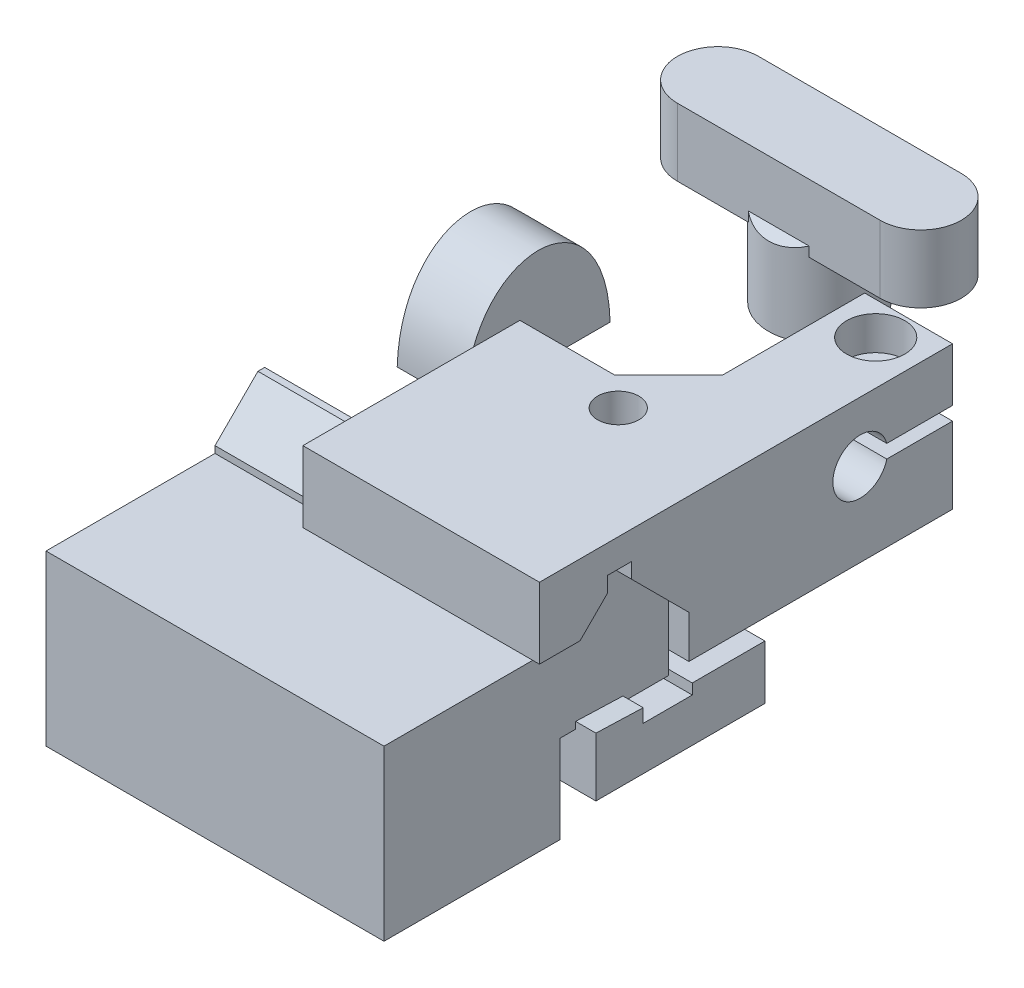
SolidWorks part; units mm, degrees
ref_plane "Top Plane" through (0, 0, 0) normal (0, 0, 1) x (1, 0, 0)
ref_plane "Front Plane" through (0, 0, 0) normal (0, 1, 0) x (1, 0, 0)
ref_plane "Right Plane" through (0, 0, 0) normal (1, 0, 0) x (0, 0, -1)
sketch "Sketch1" plane through (0, 0, 0) normal (1, 0, 0) x (0, 0, -1)
  line L0 (12.5, 12.5) -> (12.5, 13.5)
  line L7 (-12.5, 12.5) -> (12.5, 12.5)
  line L16 (-12.5, 12.5) -> (-12.5, -12.5)
  line L17 (-12.5, -12.5) -> (12.5, -12.5)
  line L18 (12.5, 12.5) -> (12.5, -12.5) construction
  line L19 (-12.5, 12.5) -> (12.5, -12.5) construction
  line L20 (-12.5, -12.5) -> (12.5, 12.5) construction
  line L21 (12.5, 13.5) -> (18.8489, 19.8489)
  line L22 (18.8489, 19.8489) -> (19.8489, 19.8489)
  line L23 (19.8489, 19.8489) -> (29.6019, 10.0958)
  line L24 (29.6019, 10.0958) -> (29.6019, 0.4958)
  line L25 (29.6019, 0.4958) -> (13.5519, 0.4958)
  line L26 (13.5519, 0.4958) -> (13.5519, -12.5)
  line L27 (12.5, -12.5) -> (13.5519, -12.5)
  line L28 (12.5, 13.5) -> (11.5, 12.5) construction
  line L29 (39.4519, 10.0958) -> (60.9519, 10.0958)
  line L30 (50.2019, 10.0958) -> (50.2019, 37.0743) construction
  line L31 (39.4519, 27.6363) -> (39.4519, -21.1762) construction
  line L32 (29.6019, 10.0958) -> (88.1638, 10.0958) construction
  spline S0 degree 3 poles (39.4519, 10.0958) (40.0358, 29.1067) (60.3681, 29.7517) (60.9519, 10.0958) knots 0 0 0 0 1 1 1 1
  point P1 (0, 0)
  point P20 (0, 0)
  dimension "D1" = 11.1
  dimension "D2" = 90
  dimension "D3" = 14.5
  dimension "D4" = 9.6
  dimension "D5" = 16.05
  dimension "D6" = 1
  dimension "D7" = 1
  dimension "D8" = 135
  dimension "D9" = 25
  dimension "D10" = 14.5
  dimension "D11" = 21.5
  dimension "D12" = 9.85
extrude "Boss-Extrude1" add sketch "Sketch1" against normal blind 10
sketch "Sketch2" plane through (0, 0, 0) normal (1, 0, 0) x (0, 0, -1)
  line L10 (-12.5, -12.5) -> (13.5519, -12.5)
  line L11 (13.5519, -12.5) -> (13.5519, 0.4958)
  line L12 (13.5519, 0.4958) -> (29.6019, 0.4958)
  line L13 (29.6019, 0.4958) -> (29.6019, 10.0958)
  line L14 (29.6019, 10.0958) -> (19.8489, 19.8489)
  line L15 (19.8489, 19.8489) -> (18.8489, 19.8489)
  line L16 (18.8489, 19.8489) -> (12.5, 13.5)
  line L17 (12.5, 13.5) -> (12.5, 12.5)
  line L18 (12.5, 12.5) -> (-12.5, 12.5)
  line L19 (-12.5, 12.5) -> (-12.5, -12.5)
  line L20 (-12.5, -12.5) -> (13.5519, -12.5)
  line L21 (13.5519, -12.5) -> (13.5519, 0.4958)
  line L22 (13.5519, 0.4958) -> (29.6019, 0.4958)
  line L23 (29.6019, 0.4958) -> (29.6019, 10.0958)
  line L24 (29.6019, 10.0958) -> (19.8489, 19.8489)
  line L25 (19.8489, 19.8489) -> (18.8489, 19.8489)
  line L26 (18.8489, 19.8489) -> (12.5, 13.5)
  line L27 (12.5, 13.5) -> (12.5, 12.5)
  line L28 (12.5, 12.5) -> (-12.5, 12.5)
  line L29 (-12.5, 12.5) -> (-12.5, -12.5)
  dimension "D1" = 0
extrude "Boss-Extrude2" add sketch "Sketch2" along normal blind 40
ref_plane "Plane1" through (30, 0, 0) normal (1, 0, 0) x (0, 0, -1)
sketch "Sketch3" plane through (30, 0, 0) normal (1, 0, 0) x (0, 0, -1)
  line L1 (39.4519, 10.0958) -> (60.9519, 10.0958)
  line L2 (39.4519, 10.0958) -> (60.9519, 10.0958) construction
  line L3 (7.5, 14.5) -> (7.5, 27.5)
  line L4 (7.5, 27.5) -> (64.6019, 27.5)
  line L6 (29.6019, 10.0958) -> (19.8489, 19.8489) construction
  line L10 (-12.5, 12.5) -> (-12.5, -12.5)
  line L11 (-12.5, -12.5) -> (13.5519, -12.5)
  line L12 (13.5519, -12.5) -> (13.5519, 0.4958)
  line L13 (13.5519, 0.4958) -> (29.6019, 0.4958)
  line L14 (29.6019, 0.4958) -> (29.6019, 10.0958)
  line L15 (29.6019, 10.0958) -> (19.8489, 19.8489)
  line L16 (19.8489, 19.8489) -> (18.8489, 19.8489)
  line L17 (18.8489, 19.8489) -> (12.5, 13.5)
  line L18 (12.5, 13.5) -> (12.5, 12.5)
  line L19 (12.5, 12.5) -> (-12.5, 12.5)
  line L20 (-12.5, 12.5) -> (-12.5, -12.5) construction
  line L21 (-12.5, -12.5) -> (13.5519, -12.5) construction
  line L22 (13.5519, -12.5) -> (13.5519, 0.4958) construction
  line L23 (13.5519, 0.4958) -> (29.6019, 0.4958) construction
  line L24 (29.6019, 0.4958) -> (29.6019, 10.0958) construction
  line L25 (29.6019, 10.0958) -> (19.8489, 19.8489) construction
  line L26 (19.8489, 19.8489) -> (18.8489, 19.8489) construction
  line L27 (18.8489, 19.8489) -> (12.5, 13.5) construction
  line L28 (12.5, 13.5) -> (12.5, 12.5) construction
  line L29 (12.5, 12.5) -> (-12.5, 12.5) construction
  line L30 (29.6019, 10.0958) -> (29.6019, 0.7958)
  line L31 (29.6019, 0.7958) -> (64.6019, 0.7958)
  line L32 (64.6019, 0.7958) -> (64.6019, 27.5)
  line L34 (13.5, 14.5) -> (7.5, 14.5)
  line L36 (17.5989, 18.5989) -> (17.5989, 20.8489)
  line L38 (29.6019, 10.0958) -> (21.0989, 18.5989)
  line L39 (21.0989, 18.5989) -> (21.0989, 20.8489)
  line L40 (19.3489, 19.8489) -> (19.3489, 21.4507) construction
  line L41 (17.5989, 20.8489) -> (19.3489, 20.8489)
  line L42 (19.3489, 20.8489) -> (21.0989, 20.8489)
  line L43 (13.5, 14.5) -> (17.5989, 18.5989)
  circle A0 centre (54.9519, 16.0958) radius 4.05
  spline S1 degree 3 poles (-2697.8887, -1126.5524) (3003.4516, 512.4412) (-2935.6643, 217.1374) (2890.523, -865.7362) knots -3.67734 -3.67734 -3.67734 -3.67734 4.722143 4.722143 4.722143 4.722143 only from (60.9519, 10.0958) to (39.4519, 10.0958)
  spline S2 degree 3 poles (60.9519, 10.0958) (60.3681, 29.7517) (40.0358, 29.1067) (39.4519, 10.0958) knots 0 0 0 0 1 1 1 1 construction
  dimension "D3" = 8.1
  dimension "D4" = 6
  dimension "D5" = 6
  dimension "D6" = 2
  dimension "D7" = 3.5
  dimension "D8" = 1
  dimension "D9" = 35
  dimension "D10" = 0.3
  dimension "D11" = 13
  dimension "D12" = 6
  dimension "D1" = 0
  dimension "D2" = 0
extrude "Boss-Extrude3" add sketch "Sketch3" along normal blind 13 separate body
sketch "Sketch10" plane through (30, 0, 0) normal (-1, 0, 0) x (0, 0, 1)
  line L0 (-39.6019, 27.5) -> (-39.6019, 0.7958)
  line L11 (-29.6019, 10.0958) -> (-21.0989, 18.5989)
  line L12 (-21.0989, 18.5989) -> (-21.0989, 20.8489)
  line L13 (-21.0989, 20.8489) -> (-17.5989, 20.8489)
  line L14 (-17.5989, 20.8489) -> (-17.5989, 18.5989)
  line L15 (-17.5989, 18.5989) -> (-13.5, 14.5)
  line L16 (-13.5, 14.5) -> (-7.5, 14.5)
  line L17 (-7.5, 14.5) -> (-7.5, 27.5)
  line L18 (-7.5, 27.5) -> (-64.6019, 27.5)
  line L19 (-64.6019, 27.5) -> (-64.6019, 0.7958)
  line L20 (-64.6019, 0.7958) -> (-29.6019, 0.7958)
  line L21 (-29.6019, 0.7958) -> (-29.6019, 10.0958)
  line L22 (-29.6019, 10.0958) -> (-21.0989, 18.5989)
  line L23 (-21.0989, 18.5989) -> (-21.0989, 20.8489)
  line L24 (-21.0989, 20.8489) -> (-17.5989, 20.8489)
  line L25 (-17.5989, 20.8489) -> (-17.5989, 18.5989)
  line L26 (-17.5989, 18.5989) -> (-13.5, 14.5)
  line L27 (-13.5, 14.5) -> (-7.5, 14.5)
  line L28 (-7.5, 14.5) -> (-7.5, 27.5)
  line L29 (-7.5, 27.5) -> (-64.6019, 27.5)
  line L30 (-64.6019, 27.5) -> (-64.6019, 0.7958)
  line L31 (-64.6019, 0.7958) -> (-29.6019, 0.7958)
  line L32 (-29.6019, 0.7958) -> (-29.6019, 10.0958)
  dimension "D2" = 10
  dimension "D1" = 0
extrude "Boss-Extrude8" add sketch "Sketch10" along normal blind 22 contours L0 M20 M22 M23 M13 M14 M15 M16 M17 M18 M19
chamfer "Chamfer2" distance 8 angle 45 1 edges at (30, 14.1479, -39.6019)
sketch "Sketch11" plane through (0, 27.5, 0) normal (0, 1, 0) x (1, 0, 0)
  line L0 (-10, 29.6019) -> (40, 29.6019) construction
  line L1 (-10, 29.6019) -> (40, 29.6019) construction
  line L2 (25.5, 7.5) -> (25.5, 64.8694) construction
  line L3 (43, 7.5) -> (8, 7.5) construction
  line L4 (40.6681, 32.6019) -> (11.2696, 32.6019) construction
  circle A0 centre (26.5, 35.6519) radius 3.05
  point P10 (27.3746, 35.6847)
  point P11 (27.0288, 35.6542)
  dimension "D3" = 6.1
  dimension "D1" = 3
  dimension "D2" = 1
extrude "Cut-Extrude4" cut sketch "Sketch11" against normal up to surface (26.7042 mm away)
sketch "Sketch13" plane through (43, 0, 0) normal (1, 0, 0) x (0, 0, -1)
  line L1 (15.851, 1.4958) -> (22.8468, 1.2515)
  line L4 (22.8468, 1.2515) -> (22.8468, -0.7485)
  line L5 (19.3489, 20.8489) -> (19.3489, -9.8371) construction
  line L6 (17.5989, 20.8489) -> (21.0989, 20.8489) construction
  line L7 (15.851, 1.4958) -> (15.851, -7.2042)
  line L8 (15.851, -7.2042) -> (40.851, -7.2042)
  line L9 (40.851, -7.2042) -> (40.851, 0.7958)
  line L10 (40.851, 0.7958) -> (30.1019, 0.7958)
  line L11 (30.1019, 0.7958) -> (30.1019, -0.7485)
  line L12 (30.1019, -0.7485) -> (22.8468, -0.7485)
  line L13 (29.6019, 0.4958) -> (29.6019, 10.0958) construction
  line L14 (13.5519, 0.4958) -> (29.6019, 0.4958) construction
  line L15 (29.6019, 0.7958) -> (64.6019, 0.7958) construction
  point P0 (22.8334, 0.9425)
  point P10 (19.3489, 1.3737)
  point P18 (0, 0)
  dimension "D1" = 6.9957
  dimension "D2" = 2
  dimension "D3" = 8
  dimension "D4" = 25
  dimension "D5" = 0.5
  dimension "D6" = 88
  dimension "D7" = 1
extrude "Boss-Extrude9" add sketch "Sketch13" against normal up to surface (35 mm away) separate body
sketch "Sketch18" plane through (0, 27.5, 0) normal (0, 1, 0) x (1, 0, 0)
  line L7 (30, 64.6019) -> (30, 47.6019)
  line L8 (30, 47.6019) -> (22, 39.6019)
  line L9 (22, 39.6019) -> (8, 39.6019)
  line L10 (8, 39.6019) -> (8, 7.5)
  line L11 (8, 7.5) -> (43, 7.5)
  line L12 (43, 7.5) -> (43, 64.6019)
  line L13 (43, 64.6019) -> (30, 64.6019)
  line L14 (30, 64.6019) -> (30, 47.6019)
  line L15 (30, 47.6019) -> (22, 39.6019)
  line L16 (22, 39.6019) -> (8, 39.6019)
  line L17 (8, 39.6019) -> (8, 7.5)
  line L18 (8, 7.5) -> (43, 7.5)
  line L19 (43, 7.5) -> (43, 64.6019)
  line L20 (43, 64.6019) -> (30, 64.6019)
  dimension "D1" = 0
extrude "Cut-Extrude8" cut sketch "Sketch18" against normal blind 2.5
sketch "Sketch19" plane through (0, 0, 0) normal (0, 1, 0) x (1, 0, 0)
  line L1 (1.0565, 88.0726) -> (2.4421, 85.6726)
  line L2 (2.4421, 85.6726) -> (5.2134, 85.6726)
  line L3 (5.2134, 85.6726) -> (6.599, 88.0726)
  line L4 (6.599, 88.0726) -> (5.2134, 90.4726)
  line L5 (5.2134, 90.4726) -> (2.4421, 90.4726)
  line L6 (2.4421, 90.4726) -> (1.0565, 88.0726)
  circle A0 centre (3.8278, 88.0726) radius 2.4 construction
  circle A1 centre (3.8278, 88.0726) radius 4.95
  circle A2 centre (3.8278, 88.0726) radius 7.5
  dimension "D1" = 4.8
  dimension "D2" = 9.9
  dimension "D3" = 15
extrude "Boss-Extrude10" add sketch "Sketch19" along normal blind 6 separate body contours A2 A1 | L5 L6 L1 L2 L3 L4
sketch "Sketch20" plane through (0, 6, 0) normal (0, 1, 0) x (1, 0, 0)
  circle A0 centre (3.8278, 88.0726) radius 7.5 construction
  circle A1 centre (3.8278, 88.0726) radius 7.5
extrude "Boss-Extrude11" add sketch "Sketch20" along normal blind 6
sketch "Sketch21" plane through (0, 12, 0) normal (0, 1, 0) x (1, 0, 0)
  line L0 (18.8278, 88.0726) -> (-11.1722, 88.0726) construction
  line L1 (18.8278, 82.0726) -> (-11.1722, 82.0726)
  line L2 (18.8278, 94.0726) -> (-11.1722, 94.0726)
  arc A0 (18.8278, 82.0726) -> (18.8278, 94.0726) centre (18.8278, 88.0726) ccw
  arc A1 (-11.1722, 94.0726) -> (-11.1722, 82.0726) centre (-11.1722, 88.0726) ccw
  point P2 (3.8278, 88.0726)
  dimension "D1" = 12
  dimension "D2" = 15
extrude "Boss-Extrude12" add sketch "Sketch21" along normal blind 10
chamfer "Chamfer3" distance 2.5 angle 30 2 edges at (3.8278, 12, -94.0726) (3.8278, 12, -82.0726)
sketch "Sketch22" plane through (0, 0, 0) normal (0, -1, 0) x (1, 0, 0)
  circle A0 centre (3.8278, -88.0726) radius 4.95 construction
  circle A1 centre (3.8278, -88.0726) radius 7.5 construction
  circle A2 centre (3.8278, -88.0726) radius 4.95
  circle A3 centre (3.8278, -88.0726) radius 7.5
extrude "Cut-Extrude9" cut sketch "Sketch22" against normal blind 1
sketch "Sketch24" plane through (0, 6, 0) normal (0, -1, 0) x (1, 0, 0)
  line L6 (2.4421, -90.4726) -> (5.2134, -90.4726)
  line L7 (1.0565, -88.0726) -> (2.4421, -90.4726)
  line L8 (2.4421, -85.6726) -> (1.0565, -88.0726)
  line L9 (5.2134, -85.6726) -> (2.4421, -85.6726)
  line L10 (6.599, -88.0726) -> (5.2134, -85.6726)
  line L11 (5.2134, -90.4726) -> (6.599, -88.0726)
  line L12 (2.4421, -90.4726) -> (5.2134, -90.4726)
  line L13 (1.0565, -88.0726) -> (2.4421, -90.4726)
  line L14 (2.4421, -85.6726) -> (1.0565, -88.0726)
  line L15 (5.2134, -85.6726) -> (2.4421, -85.6726)
  line L16 (6.599, -88.0726) -> (5.2134, -85.6726)
  line L17 (5.2134, -90.4726) -> (6.599, -88.0726)
  circle A0 centre (3.8278, -88.0726) radius 4.95 construction
  circle A1 centre (3.8278, -88.0726) radius 4.95
  dimension "D1" = 0
extrude "Boss-Extrude13" add sketch "Sketch24" along normal blind 2
chamfer "Chamfer4" distance 1 angle 45 6 edges at (5.9062, 0, -86.8726) (5.9062, 0, -89.2726) (3.8278, 0, -90.4726) (1.7493, 0, -89.2726) (1.7493, 0, -86.8726) (3.8278, 0, -85.6726)
sketch "Sketch25" plane through (0, 0.7958, 0) normal (0, -1, 0) x (1, 0, 0)
  line L7 (43, -29.6019) -> (8, -29.6019)
  line L8 (8, -29.6019) -> (8, -39.6019)
  line L9 (8, -39.6019) -> (22, -39.6019)
  line L10 (22, -39.6019) -> (30, -47.6019)
  line L11 (30, -47.6019) -> (30, -64.6019)
  line L12 (30, -64.6019) -> (43, -64.6019)
  line L13 (43, -64.6019) -> (43, -29.6019)
  line L14 (43, -29.6019) -> (8, -29.6019)
  line L15 (8, -29.6019) -> (8, -39.6019)
  line L16 (8, -39.6019) -> (22, -39.6019)
  line L17 (22, -39.6019) -> (30, -47.6019)
  line L18 (30, -47.6019) -> (30, -64.6019)
  line L19 (30, -64.6019) -> (43, -64.6019)
  line L20 (43, -64.6019) -> (43, -29.6019)
  circle A0 centre (26.5, -35.6519) radius 3.05 construction
  circle A1 centre (26.5, -35.6519) radius 3.05
  dimension "D1" = 0
extrude "Cut-Extrude11" cut sketch "Sketch25" against normal blind 3 contours L14 L15 L16 L17 L18 L19 L20
sketch "Sketch37" plane through (0, -7.2042, 0) normal (0, -1, 0) x (1, 0, 0)
  circle A0 centre (26.5, -35.6519) radius 3.05 construction
  circle A1 centre (26.5, -35.6519) radius 3.05
extrude "Cut-Extrude20" cut sketch "Sketch37" against normal up to next
sketch "Sketch27" plane through (0, -7.2042, 0) normal (0, -1, 0) x (1, 0, 0)
  line L1 (20.6688, -35.6519) -> (23.5844, -40.7019)
  line L2 (23.5844, -40.7019) -> (29.4156, -40.7019)
  line L3 (29.4156, -40.7019) -> (32.3312, -35.6519)
  line L4 (32.3312, -35.6519) -> (29.4156, -30.6019)
  line L5 (29.4156, -30.6019) -> (23.5844, -30.6019)
  line L6 (23.5844, -30.6019) -> (20.6688, -35.6519)
  circle A0 centre (26.5, -35.6519) radius 5.05 construction
  circle A1 centre (26.5, -35.6519) radius 3.05 construction
  circle A2 centre (26.5, -35.6519) radius 3.05
  point P1 (26.5, -29.8207)
  point P10 (20.6688, -35.6519)
  point P14 (31.2182, -31.108)
  point P15 (0, 0)
  dimension "D1" = 10.1
extrude "Cut-Extrude12" cut sketch "Sketch27" against normal blind 5.5
sketch "Sketch28" plane through (0, 0, -64.6019) normal (0, 0, -1) x (-1, 0, 0)
  line L0 (-43, 20.1458) -> (-43, 12.0458) construction
  line L1 (-43, 20.1458) -> (-43, 12.0458) construction
  line L2 (-43, 16.0958) -> (-30, 16.0958) construction
  line L3 (-30, 3.7958) -> (-30, 25) construction
  line L5 (-43, 17.0958) -> (-30, 17.0958)
  line L6 (-43, 17.0958) -> (-43, 15.0958)
  line L7 (-43, 15.0958) -> (-30, 15.0958)
  line L8 (-30, 17.0958) -> (-30, 15.0958)
  point P10 (-43, 17.8726)
  point P11 (0, 0)
  point P12 (-43, 16.0958)
  dimension "D1" = 1
extrude "Cut-Extrude13" cut sketch "Sketch28" against normal up to next
sketch "Sketch30" plane through (0, 0, -64.6019) normal (0, 0, -1) x (-1, 0, 0)
  line L0 (-30, 3.7958) -> (-30, 15.0958) construction
  line L1 (-30, 15.0958) -> (-43, 15.0958) construction
  line L2 (-43, 15.0958) -> (-43, 3.7958) construction
  line L3 (-43, 3.7958) -> (-30, 3.7958) construction
  line L4 (-43, 25) -> (-43, 17.0958) construction
  line L5 (-43, 17.0958) -> (-30, 17.0958) construction
  line L6 (-30, 17.0958) -> (-30, 25) construction
  line L7 (-30, 25) -> (-43, 25) construction
  line L8 (-30, 3.7958) -> (-30, 15.0958)
  line L9 (-30, 15.0958) -> (-43, 15.0958)
  line L10 (-43, 15.0958) -> (-43, 3.7958)
  line L11 (-43, 3.7958) -> (-30, 3.7958)
  line L12 (-43, 25) -> (-43, 17.0958)
  line L13 (-43, 17.0958) -> (-30, 17.0958)
  line L14 (-30, 17.0958) -> (-30, 25)
  line L15 (-30, 25) -> (-43, 25)
extrude "Boss-Extrude15" add sketch "Sketch30" along normal blind 4
sketch "Sketch29" plane through (0, 25, 0) normal (0, 1, 0) x (1, 0, 0)
  line L0 (43, 63.7392) -> (30, 63.7392) construction
  line L4 (43, 58.8765) -> (43, 68.6019)
  line L5 (43, 68.6019) -> (30, 68.6019)
  line L6 (30, 68.6019) -> (30, 58.8765)
  line L7 (30, 58.8765) -> (43, 58.8765)
  line L8 (43, 58.8765) -> (43, 68.6019) construction
  line L10 (30, 68.6019) -> (30, 58.8765) construction
  line L11 (30, 58.8765) -> (43, 58.8765) construction
  line L13 (43, 68.6019) -> (30, 68.6019)
  circle A0 centre (36.5, 63.7392) radius 2.1
  point P6 (38.2475, 60.841)
  point P7 (36.5, 63.7392)
  point P10 (34.8727, 61.7392)
  point P11 (0, 0)
  point P12 (43, 63.7392)
  dimension "D2" = 4.2
  dimension "D1" = 0
extrude "Cut-Extrude14" cut sketch "Sketch29" against normal up to surface (21.2042 mm away) contours A0
sketch "Sketch31" plane through (0, 25, 0) normal (0, 1, 0) x (1, 0, 0)
  circle A0 centre (36.5, 63.7392) radius 4.3
  dimension "D1" = 8.6
extrude "Cut-Extrude15" cut sketch "Sketch31" against normal blind 5
sketch "Sketch32" plane through (0, 20, 0) normal (0, 1, 0) x (1, 0, 0)
  circle A0 centre (36.5, 63.7392) radius 2.6
  dimension "D1" = 5.2
extrude "Cut-Extrude19" cut sketch "Sketch32" against normal up to next
sketch "Sketch38" plane through (0, -1.7042, 0) normal (0, -1, 0) x (1, 0, 0)
  circle A0 centre (26.5, -35.6519) radius 3.05 construction
  circle A1 centre (26.5, -35.6519) radius 3.05
extrude "Boss-Extrude18" add sketch "Sketch38" against normal blind 0.2
